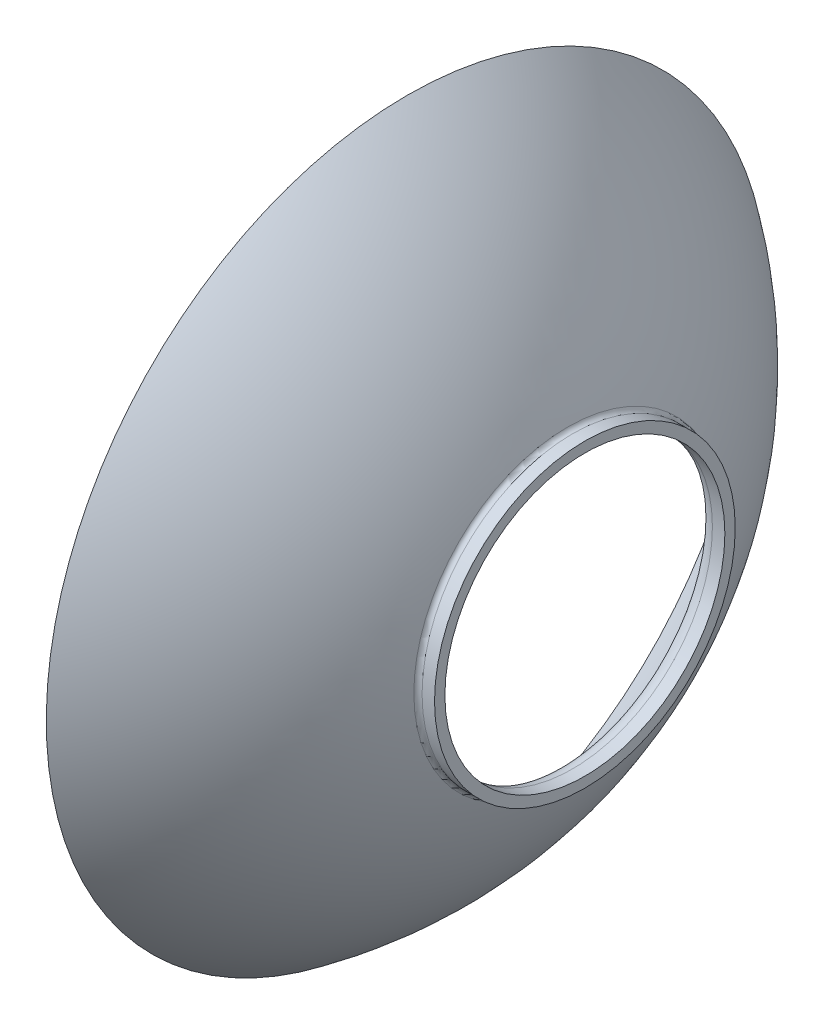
SolidWorks part; units mm, degrees
ref_plane "Plan de face" through (0, 0, 0) normal (0, 0, 1) x (1, 0, 0)
ref_plane "Plan de dessus" through (0, 0, 0) normal (0, 1, 0) x (1, 0, 0)
ref_plane "Plan de droite" through (0, 0, 0) normal (1, 0, 0) x (0, 0, -1)
sketch "Esquisse1" plane through (0, 0, 0) normal (0, 0, 1) x (1, 0, 0)
  line L0 (0, 0) -> (62.5556, 0) construction
  line L1 (0, 0) -> (23.8034, 33.9948) construction
  line L4 (40.2989, 13.5) -> (41.5, 13.5)
  arc A0 (38.8931, 14.4767) -> (23.8034, 33.9948) centre (0, 0) ccw
  arc A1 (40.2989, 13.5) -> (38.8931, 14.4767) centre (40.2989, 15) cw
  dimension "D1" = 83
  dimension "D2" = 55
  dimension "D4" = 1.5
  dimension "D3" = 27
  dimension "D5" = 41.5
revolve "Révol.-Mince1" add sketch "Esquisse1" angle 360 about L0
